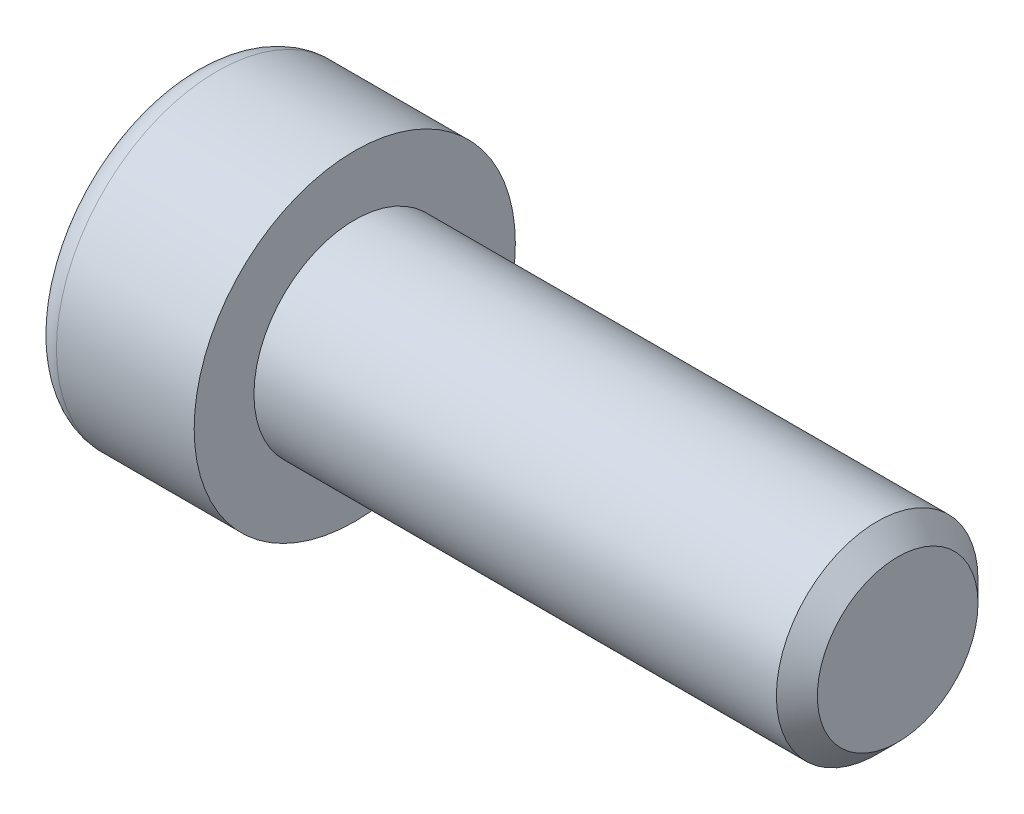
SolidWorks part; units mm, degrees
ref_plane "Plan de face" through (0, 0, 0) normal (0, 0, 1) x (1, 0, 0)
ref_plane "Plan de dessus" through (0, 0, 0) normal (0, 1, 0) x (1, 0, 0)
ref_plane "Plan de droite" through (0, 0, 0) normal (1, 0, 0) x (0, 0, -1)
sketch "Esquisse1" plane through (0, 0, 0) normal (0, 0, 1) x (1, 0, 0)
  line L0 (-405.4512, 342.4517) -> (-381.6619, 342.4517) construction
  line L3 (-384.7241, 346.4517) -> (-405.4512, 346.4517)
  line L4 (-383.9111, 345.6388) -> (-383.9111, 342.4517)
  line L5 (-383.9111, 342.4517) -> (-411.9166, 342.4517)
  line L6 (-383.9111, 345.6388) -> (-384.7241, 346.4517)
  line L9 (-405.4512, 346.4517) -> (-405.4512, 348.8231)
  line L10 (-405.4512, 348.8231) -> (-410.9166, 348.8231)
  line L11 (-411.9166, 342.4517) -> (-411.9166, 347.8231)
  arc A0 (-410.9166, 348.8231) -> (-411.9166, 347.8231) centre (-410.9166, 347.8231) ccw
  dimension "D1" = 1
  dimension "D2" = 4
  dimension "D3" = 21.5401
revolve "Révolution1" add sketch "Esquisse1" angle 360 about L5
sketch "Esquisse2" plane through (-411.9166, 0, 0) normal (-1, 0, 0) x (0, 0, 1)
  line L1 (-3.2693, 343.387) -> (-2.4446, 340.088)
  line L2 (-2.4446, 340.088) -> (0.8247, 339.1528)
  line L3 (0.8247, 339.1528) -> (3.2693, 341.5165)
  line L4 (3.2693, 341.5165) -> (2.4446, 344.8154)
  line L5 (2.4446, 344.8154) -> (-0.8247, 345.7507)
  line L6 (-0.8247, 345.7507) -> (-3.2693, 343.387)
  circle A0 centre (0, 342.4517) radius 2.9449 construction
extrude "Enlèv. mat.-Extru.1" cut sketch "Esquisse2" against normal blind 3
fillet "Congé1" radius 0.5 6 edges at (-408.9166, 345.2831, 0.81) (-408.9166, 343.166, 2.857) (-408.9166, 340.3346, 2.047) (-408.9166, 339.6204, -0.81) (-408.9166, 341.7375, -2.857) (-408.9166, 344.5689, -2.047)
